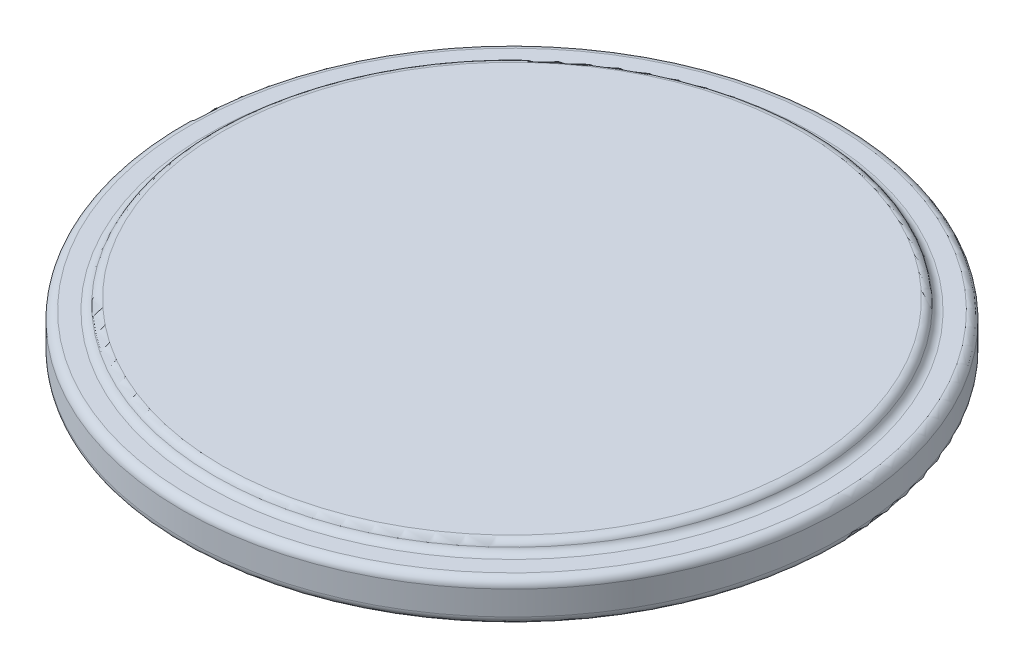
SolidWorks part; units mm, degrees
ref_plane "Front Plane" through (0, 0, 0) normal (0, 0, 1) x (1, 0, 0)
ref_plane "Top Plane" through (0, 0, 0) normal (0, 1, 0) x (1, 0, 0)
ref_plane "Right Plane" through (0, 0, 0) normal (1, 0, 0) x (0, 0, -1)
sketch "Sketch1" plane through (0, 0, 0) normal (1, 0, 0) x (0, 0, -1)
  line L0 (0, 0) -> (0, 11.8131) construction
  line L1 (0, 0) -> (8.89, 0)
  line L2 (8.89, 0) -> (20.32, 6.5991)
  line L3 (20.32, 6.5991) -> (20.32, 9.525)
  line L4 (20.32, 9.525) -> (0, 9.525)
  line L5 (0, 0) -> (0, 9.525)
  dimension "D1" = 9.525
  dimension "D2" = 17.78
  dimension "D3" = 60
  dimension "D4" = 40.64
revolve "Revolve1" add sketch "Sketch1" angle 360 about L0
fillet "Fillet1" radius 0.508 3 edges at (0, 9.525, -20.32) (0, 6.5991, -20.32) (0, 0, -8.89)
sketch "Sketch2" plane through (0, 9.525, 0) normal (0, 1, 0) x (1, 0, 0)
  circle A0 centre (0, 0) radius 18.288
  circle A1 centre (0, 0) radius 20.32 construction
  dimension "D1" = 36.576
  dimension "D2" = 2.032
extrude "Cut-Extrude1" cut sketch "Sketch2" against normal offset from surface (0.635 mm away) 8.89 flip side to cut
fillet "Fillet2" radius 0.508 2 edges at (0, 8.89, -20.32) (0, 8.89, -18.288)
fillet "Fillet3" radius 0.508 1 edges at (0, 9.525, 18.288)
sketch "Sketch3" [suppressed] plane through (0, 0, 0) normal (0, -1, 0) x (1, 0, 0)
  circle A0 centre (0, 0) radius 17.145
  dimension "D1" = 34.29
